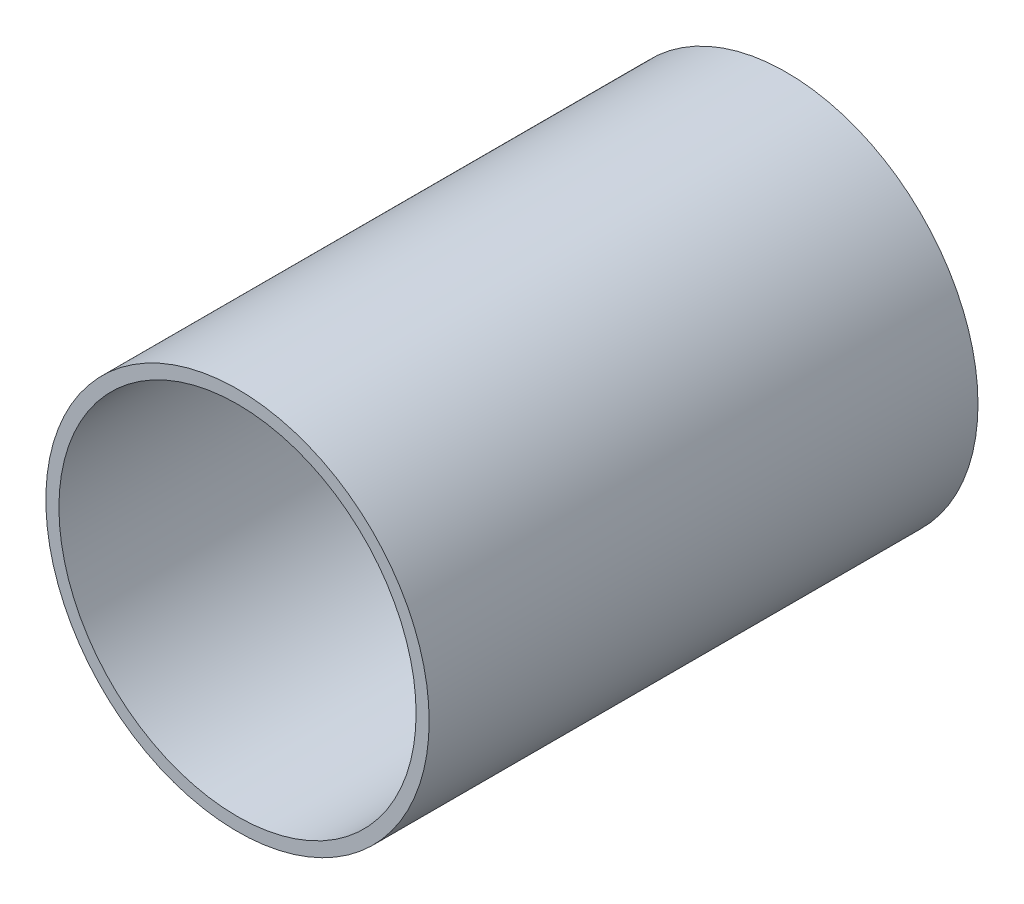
SolidWorks part; units mm, degrees
ref_plane "Plan de face" through (0, 0, 0) normal (0, 0, 1) x (1, 0, 0)
ref_plane "Plan de dessus" through (0, 0, 0) normal (0, 1, 0) x (1, 0, 0)
ref_plane "Plan de droite" through (0, 0, 0) normal (1, 0, 0) x (0, 0, -1)
sketch "Esquisse1" plane through (0, 0, 0) normal (0, 0, 1) x (1, 0, 0)
  circle A0 centre (0, 0) radius 22
  circle A1 centre (0, 0) radius 20.5
  dimension "D1" = 41
  dimension "D2" = 44
extrude "Extrusion1" add sketch "Esquisse1" along normal blind 63
